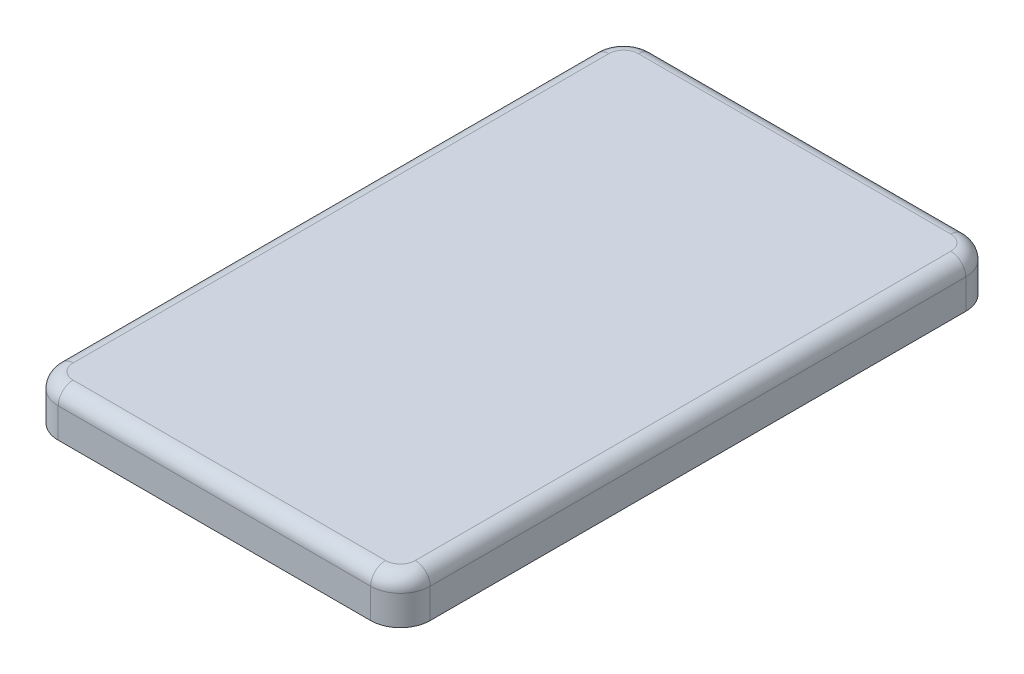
SolidWorks part; units mm, degrees
ref_plane "正面" through (0, 0, 0) normal (0, 0, 1) x (1, 0, 0)
ref_plane "平面" through (0, 0, 0) normal (0, 1, 0) x (1, 0, 0)
ref_plane "右側面" through (0, 0, 0) normal (1, 0, 0) x (0, 0, -1)
sketch "ｽｹｯﾁ1" plane through (0, 0, 0) normal (0, 1, 0) x (1, 0, 0)
  line L1 (2, 0) -> (23, 0)
  line L2 (0, 2) -> (0, 38)
  line L3 (2, 40) -> (23, 40)
  line L4 (25, 2) -> (25, 38)
  arc A0 (2, 40) -> (0, 38) centre (2, 38) ccw
  arc A1 (25, 38) -> (23, 40) centre (23, 38) ccw
  arc A2 (23, 0) -> (25, 2) centre (23, 2) ccw
  arc A3 (0, 2) -> (2, 0) centre (2, 2) ccw
  point P9 (25, 40)
  point P12 (25, 0)
  point P15 (0, 0)
  dimension "D3" = 2
  dimension "D1" = 25
  dimension "D2" = 40
extrude "押し出し1" add sketch "ｽｹｯﾁ1" along normal blind 3
fillet "ﾌｨﾚｯﾄ1" radius 1 8 edges at (0.5858, 3, -0.5858) (0, 3, -20) (0.5858, 3, -39.4142) (12.5, 3, -40) (24.4142, 3, -39.4142) (25, 3, -20) (24.4142, 3, -0.5858) (12.5, 3, 0)
sketch "ｽｹｯﾁ2" plane through (0, 0, 0) normal (0, -1, 0) x (1, 0, 0)
  line L0 (23, -40) -> (2, -40) construction
  line L1 (1.5, -38.5) -> (23.5, -38.5)
  line L2 (1.5, -38.5) -> (1.5, -1.5)
  line L3 (1.5, -1.5) -> (23.5, -1.5)
  line L4 (23.5, -38.5) -> (23.5, -1.5)
  line L5 (0, -38) -> (0, -2) construction
  dimension "D1" = 22
  dimension "D2" = 37
  dimension "D3" = 1.5
  dimension "D4" = 1.5
extrude "押し出し2" cut sketch "ｽｹｯﾁ2" against normal blind 1
sketch "ｽｹｯﾁ3" plane through (0, 1, 0) normal (0, -1, 0) x (1, 0, 0)
  line L1 (7.6, -26.65) -> (12.4, -26.65)
  line L2 (7.6, -26.65) -> (7.6, -23.35)
  line L3 (7.6, -23.35) -> (12.4, -23.35)
  line L4 (12.4, -26.65) -> (12.4, -23.35)
  line L5 (23.5, -1.5) -> (1.5, -1.5) construction
  line L6 (1.5, -1.5) -> (1.5, -38.5) construction
  line L7 (23.5, -38.5) -> (23.5, -1.5) construction
  line L8 (7.6, -25) -> (12.4, -25) construction
  line L9 (10, -23.35) -> (10, -26.65) construction
  line L11 (1.5, -38.5) -> (23.5, -38.5) construction
  dimension "D1" = 4.8
  dimension "D2" = 3.3
  dimension "D3" = 11.85
  dimension "D4" = 21.85
  dimension "D5" = 6.1
  dimension "D6" = 11.1
extrude "押し出し3" add sketch "ｽｹｯﾁ3" along normal blind 8 draft 0.4
fillet "ﾌｨﾚｯﾄ3" radius 0.3 8 edges at (12.4, 1, -25) (10, 1, -26.65) (7.6, 1, -25) (10, 1, -23.35) (12.3721, -3, -26.6221) (7.6279, -3, -26.6221) (7.6279, -3, -23.3779) (12.3721, -3, -23.3779)
fillet "ﾌｨﾚｯﾄ2" radius 1.5 8 edges at (10, -7, -23.4059) (7.6559, -7, -25) (10, -7, -26.5941) (12.3441, -7, -25) (12.2563, -7, -26.5063) (7.7437, -7, -26.5063) (7.7437, -7, -23.4937) (12.2563, -7, -23.4937)
sketch "ｽｹｯﾁ4" plane through (0, 1, 0) normal (0, -1, 0) x (1, 0, 0)
  line L0 (10, -7.45) -> (10, -8.55) construction
  line L1 (7.3, -8.55) -> (12.7, -8.55)
  line L2 (7.3, -8.55) -> (7.3, -7.45)
  line L3 (7.3, -7.45) -> (12.7, -7.45)
  line L4 (12.7, -8.55) -> (12.7, -7.45)
  line L5 (1.5, -1.5) -> (1.5, -38.5) construction
  line L6 (23.5, -38.5) -> (23.5, -1.5) construction
  line L7 (1.5, -38.5) -> (23.5, -38.5) construction
  line L8 (7.3, -8) -> (12.7, -8) construction
  dimension "D1" = 5.4
  dimension "D2" = 1.1
  dimension "D3" = 10.8
  dimension "D4" = 5.8
  dimension "D5" = 29.95
extrude "押し出し4" add sketch "ｽｹｯﾁ4" along normal blind 3 draft 1
fillet "ﾌｨﾚｯﾄ4" radius 0.2 12 edges at (1.5, 1, -20) (12.5, 1, -38.5) (23.5, 1, -20) (12.5, 1, -1.5) (10, -2, -8.4976) (10, -2, -7.5024) (7.3524, -2, -8) (12.6476, -2, -8) (12.6738, -0.5, -7.4762) (12.6738, -0.5, -8.5238) (7.3262, -0.5, -8.5238) (7.3262, -0.5, -7.4762)
fillet "ﾌｨﾚｯﾄ5" radius 0.5 16 edges at (1.5586, 0.9414, -1.5586) (23.4414, 0.9414, -1.5586) (23.4414, 0.9414, -38.4414) (1.5586, 0.9414, -38.4414) (7.3586, 1, -8.4914) (7.3, 1, -8) (7.3586, 1, -7.5086) (10, 1, -7.45) (12.6414, 1, -7.5086) (12.7, 1, -8) (12.6414, 1, -8.4914) (1.5, 0.4, -38.5) (23.5, 0.4, -38.5) (23.5, 0.4, -1.5) (1.5, 0.4, -1.5) (10, 1, -8.55)
sketch "ｽｹｯﾁ5" plane through (0, 1, 0) normal (0, -1, 0) x (1, 0, 0)
  line L0 (18, -15) -> (18, -25) construction
  line L1 (0, -38) -> (0, -2) construction
  line L2 (2, 0) -> (23, 0) construction
  text T1 "J3CML" font "MS UI Gothic" height in points 6
  dimension "D1" = 18
  dimension "D2" = 15
  dimension "D3" = 10
extrude "押し出し5" add sketch "ｽｹｯﾁ5" along normal blind 0.2
